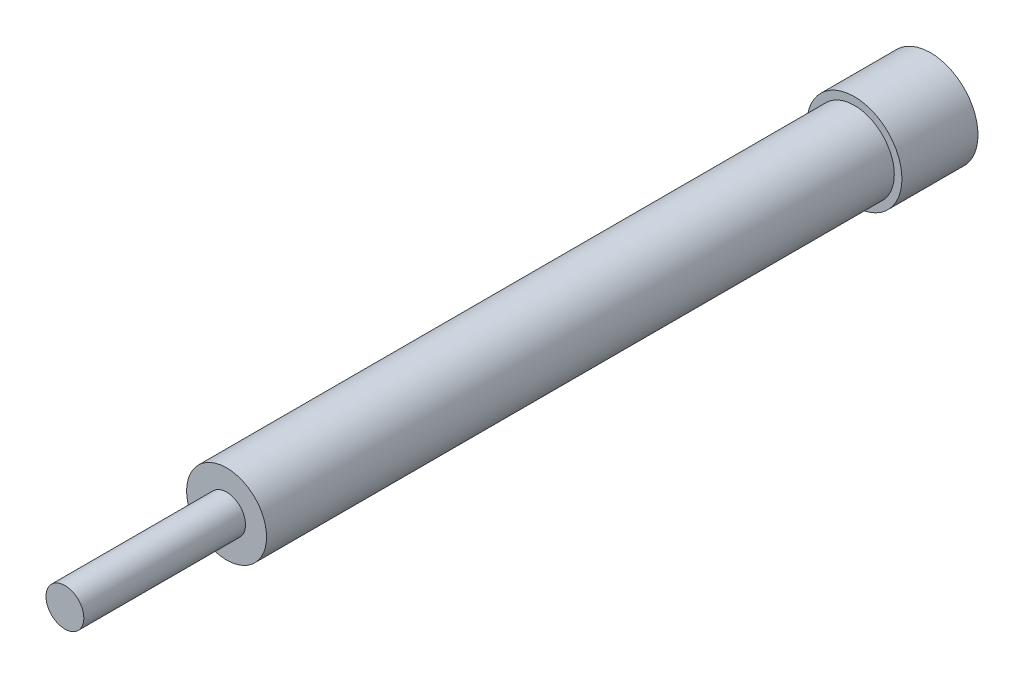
SolidWorks part; units mm, degrees
ref_plane "Vorne" through (0, 0, 0) normal (0, 0, 1) x (1, 0, 0)
ref_plane "Oben" through (0, 0, 0) normal (0, 1, 0) x (1, 0, 0)
ref_plane "Rechts" through (0, 0, 0) normal (1, 0, 0) x (0, 0, -1)
sketch "Skizze1" plane through (0, 0, 0) normal (0, 0, 1) x (1, 0, 0)
  line L0 (-77.2387, 0) -> (79.0668, 0) construction
  line L1 (0, 57.1292) -> (0, -62.3089) construction
  circle A0 centre (0, 0) radius 25
extrude "Basis-Linear austragen" add sketch "Skizze1" against normal blind 40
sketch "Skizze2" plane through (0, 0, 0) normal (0, 0, 1) x (1, 0, 0)
  circle A1 centre (0, 0) radius 25 construction
  circle A3 centre (0, 0) radius 21
  dimension "D1" = 42
extrude "Aufsatz-Linear austragen1" add sketch "Skizze2" along normal blind 330
sketch "Skizze3" plane through (0, 0, 330) normal (0, 0, 1) x (1, 0, 0)
  circle A2 centre (0, 0) radius 21 construction
  circle A3 centre (0, 0) radius 9.95
  dimension "D1" = 19.9
extrude "Aufsatz-Linear austragen2" add sketch "Skizze3" along normal blind 85
